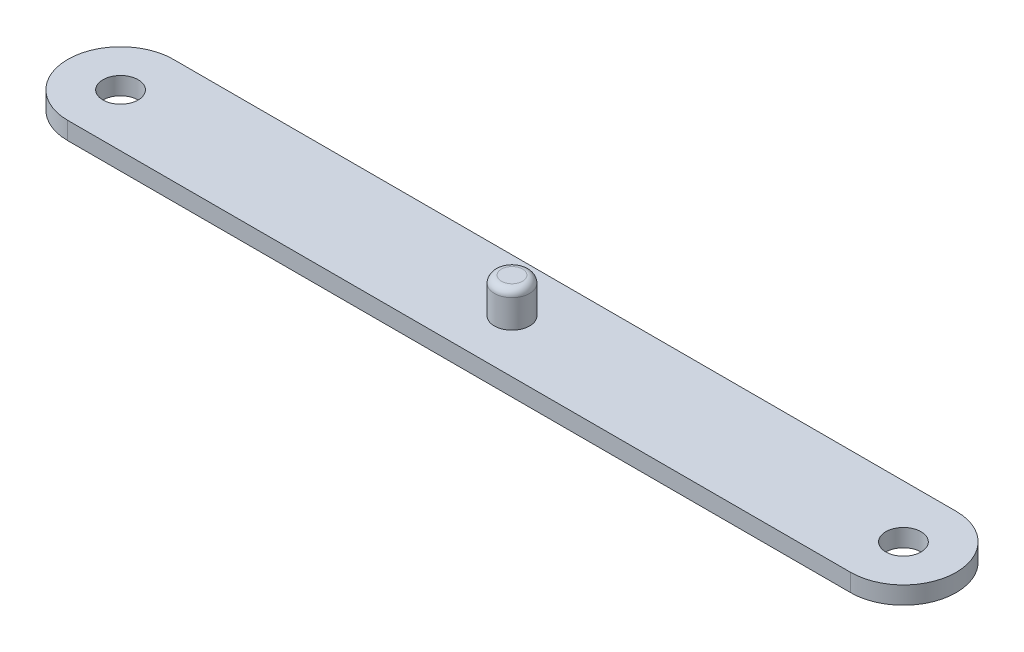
SolidWorks part; units mm, degrees
ref_plane "Front Plane" through (0, 0, 0) normal (0, 0, 1) x (1, 0, 0)
ref_plane "Top Plane" through (0, 0, 0) normal (0, 1, 0) x (1, 0, 0)
ref_plane "Right Plane" through (0, 0, 0) normal (1, 0, 0) x (0, 0, -1)
sketch "Sketch1" plane through (0, 0, 0) normal (0, 1, 0) x (1, 0, 0)
  line L1 (-141.1605, -19.05) -> (141.1605, -19.05)
  line L3 (-141.1605, 19.05) -> (141.1605, 19.05)
  line L5 (-141.1605, -19.05) -> (141.1605, 19.05) construction
  line L6 (-141.1605, 19.05) -> (141.1605, -19.05) construction
  arc A0 (-141.1605, 19.05) -> (-141.1605, -19.05) centre (-141.1605, 0) ccw
  arc A1 (141.1605, 19.05) -> (141.1605, -19.05) centre (141.1605, 0) cw
  point P0 (0, 0)
  dimension "D1" = 282.321
  dimension "D2" = 38.1
extrude "Boss-Extrude1" add sketch "Sketch1" along normal mid plane 6.35
sketch "Sketch2" plane through (0, 3.175, 0) normal (0, 1, 0) x (1, 0, 0)
  line L0 (0, -19.05) -> (0, 19.05) construction
  line L1 (-141.1605, -19.05) -> (141.1605, -19.05) construction
  line L2 (-141.1605, 19.05) -> (141.1605, 19.05) construction
  circle A0 centre (-141.1605, 0) radius 6.35
  circle A1 centre (141.1605, 0) radius 6.35
  dimension "D1" = 12.7
extrude "Cut-Extrude1" cut sketch "Sketch2" along direction (0, -1, 0) on the side against the normal through all
sketch "Sketch3" plane through (0, 3.175, 0) normal (0, 1, 0) x (1, 0, 0)
  circle A0 centre (0, 0) radius 6.35
  dimension "D1" = 12.7
extrude "Boss-Extrude2" add sketch "Sketch3" along normal blind 12.7
fillet "Fillet1" radius 2.54 1 edges at (0, 15.875, 6.35)
